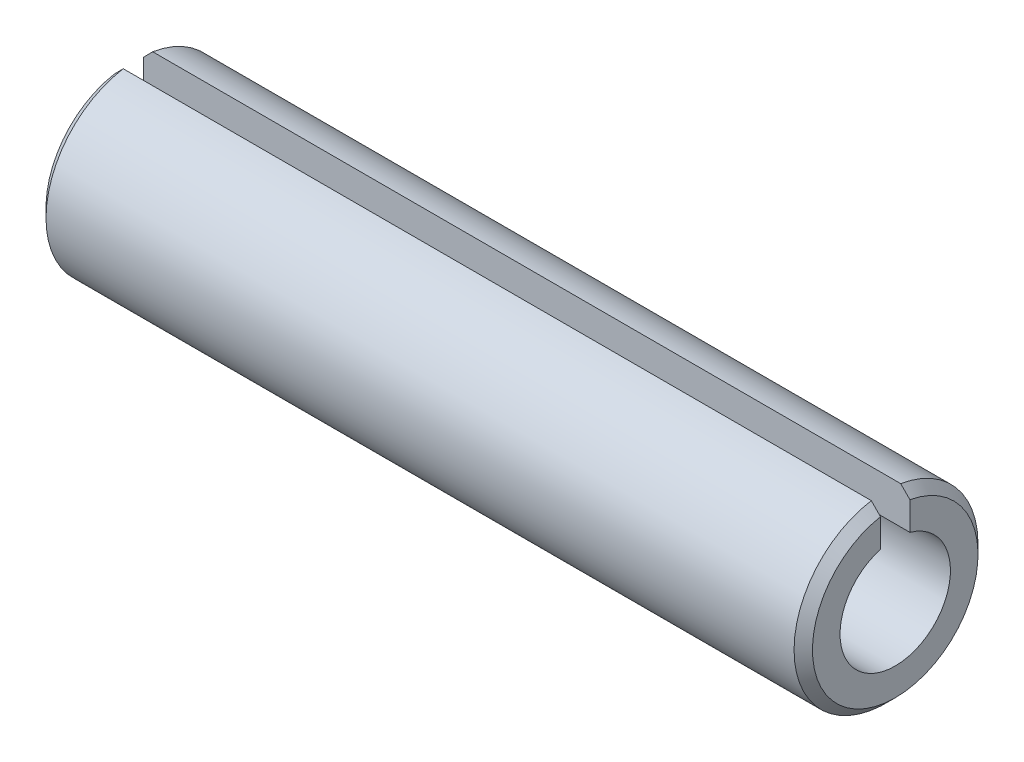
SolidWorks part; units mm, degrees
ref_plane "Plan1" through (0, 0, 0) normal (0, 0, 1) x (1, 0, 0)
ref_plane "Plan2" through (0, 0, 0) normal (0, 1, 0) x (1, 0, 0)
ref_plane "Plan3" through (0, 0, 0) normal (1, 0, 0) x (0, 0, -1)
sketch "Esquisse1" plane through (0, 0, 0) normal (0, 0, 1) x (1, 0, 0)
  line L0 (0, 1.8) -> (0, 2.7)
  line L1 (0, 1.8) -> (25, 1.8)
  line L2 (25, 1.8) -> (25, 2.7)
  line L3 (25, 2.7) -> (24.7, 3)
  line L4 (24.7, 3) -> (0.3, 3)
  line L5 (0.3, 3) -> (0, 2.7)
  line L6 (0, 0) -> (25, 0) construction
  dimension "D1" = 25
  dimension "D2" = 3
  dimension "D3" = 1.2
  dimension "D4" = 45
  dimension "D5" = 45
  dimension "D6" = 0.3
revolve "Base-Révolution" add sketch "Esquisse1" angle 360 about L6
sketch "Esquisse2" plane through (0, 0, 0) normal (1, 0, 0) x (0, 0, -1)
  line L0 (0, 0) -> (0, 3) construction
  line L1 (0.48, 2.9614) -> (0.48, 1.7348)
  line L2 (-0.48, 2.9614) -> (-0.48, 1.7348)
  circle A0 centre (0, 0) radius 3 construction
  circle A1 centre (0, 0) radius 1.8 construction
  arc A2 (0.48, 1.7348) -> (-0.48, 1.7348) centre (0, 0) ccw
  arc A3 (0.48, 2.9614) -> (-0.48, 2.9614) centre (0, 0) ccw
  dimension "D1" = 0.48
extrude "Enlèv. mat.-Extru.2" cut sketch "Esquisse2" along normal through all
equation "\"D6@Esquisse1\"=\"D2@Esquisse1\"/10"
equation "\"D1@Esquisse2\"=\"D3@Esquisse1\"/2.5"
